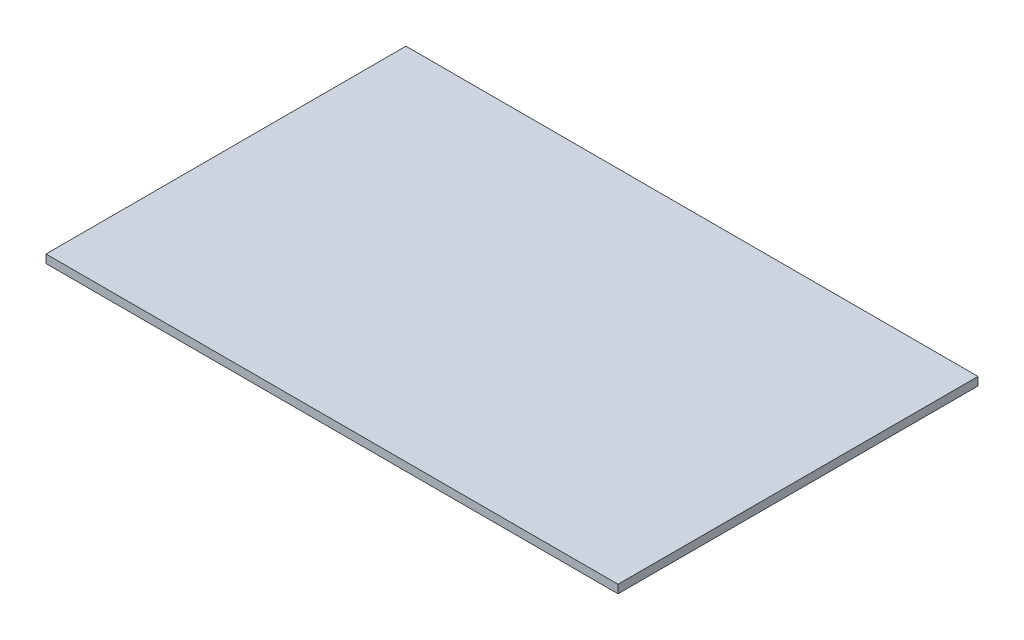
SolidWorks part; units mm, degrees
ref_plane "Front Plane" through (0, 0, 0) normal (0, 0, 1) x (1, 0, 0)
ref_plane "Top Plane" through (0, 0, 0) normal (0, 1, 0) x (1, 0, 0)
ref_plane "Right Plane" through (0, 0, 0) normal (1, 0, 0) x (0, 0, -1)
sketch "Sketch3" plane through (0, 0, 0) normal (0, 1, 0) x (1, 0, 0)
  line L1 (-206.6, -130) -> (206.6, -130)
  line L2 (-206.6, -130) -> (-206.6, 130)
  line L3 (-206.6, 130) -> (206.6, 130)
  line L4 (206.6, -130) -> (206.6, 130)
  line L5 (-206.6, -130) -> (206.6, 130) construction
  line L6 (-206.6, 130) -> (206.6, -130) construction
  point P0 (0, 0)
  dimension "D1" = 413.2
  dimension "D2" = 260
extrude "Boss-Extrude2" add sketch "Sketch3" along normal blind 6
